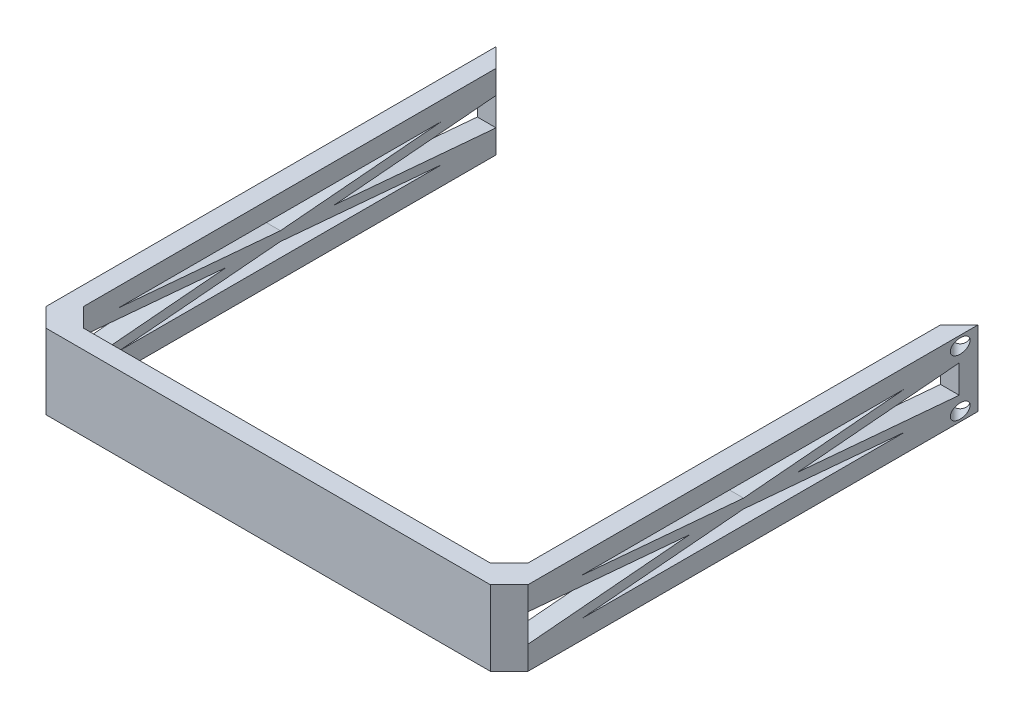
SolidWorks part; units mm, degrees
ref_plane "Front Plane" through (0, 0, 0) normal (0, 0, 1) x (1, 0, 0)
ref_plane "Top Plane" through (0, 0, 0) normal (0, 1, 0) x (1, 0, 0)
ref_plane "Right Plane" through (0, 0, 0) normal (1, 0, 0) x (0, 0, -1)
sketch "Sketch2" plane through (0, 0, 0) normal (0, 0, 1) x (1, 0, 0)
  line L1 (-16.0621, 9.0407) -> (-12.0621, 9.0407)
  line L2 (-16.0621, 9.0407) -> (-16.0621, -6.9593)
  line L3 (-16.0621, -6.9593) -> (-12.0621, -6.9593)
  line L4 (-12.0621, 9.0407) -> (-12.0621, -6.9593)
  dimension "D1" = 16
  dimension "D2" = 4
extrude "Boss-Extrude1" add sketch "Sketch2" along normal blind 100
sketch "Sketch3" plane through (-12.0621, 0, 0) normal (1, 0, 0) x (0, 0, -1)
  line L0 (-100, -6.9593) -> (0, -6.9593) construction
  line L1 (-100, 9.0407) -> (-96, 9.0407)
  line L2 (-100, 9.0407) -> (-100, -6.9593)
  line L3 (-100, -6.9593) -> (-96, -6.9593)
  line L4 (-96, 9.0407) -> (-96, -6.9593)
  dimension "D1" = 4
extrude "Boss-Extrude2" add sketch "Sketch3" along normal blind 47.395
chamfer "Chamfer1" distance 4 angle 45 1 edges at (-12.0621, 1.0407, 0)
sketch "Sketch4" plane through (-16.0621, 0, 0) normal (-1, 0, 0) x (0, 0, 1)
  line L4 (4, 5.0407) -> (96, -2.9593)
  line L5 (96, 5.0407) -> (4, -2.9593)
  line L6 (95.9134, 6.0369) -> (3.9134, -1.9631)
  line L7 (3.9134, 4.0444) -> (95.9134, -3.9556)
  line L8 (4, 5.0407) -> (4, -2.9593)
  line L9 (4, -2.9593) -> (96, -2.9593)
  line L10 (96, -2.9593) -> (96, 5.0407)
  line L11 (96, 5.0407) -> (4, 5.0407)
  line L12 (4, 5.0407) -> (4, -2.9593)
  line L13 (4, -2.9593) -> (96, -2.9593)
  line L14 (96, -2.9593) -> (96, 5.0407)
  line L15 (96, 5.0407) -> (4, 5.0407)
  line L16 (96.0866, 4.0444) -> (4.0866, -3.9556)
  line L17 (4.0866, 6.0369) -> (96.0866, -1.9631)
  dimension "D1" = 4
  dimension "D2" = 1
  dimension "D3" = 1
extrude "Cut-Extrude1" cut sketch "Sketch4" against normal blind 70 contours L15 L17 L6 | L16 L17 L14 | L7 L16 L13 | L7 L12 L6
chamfer "Chamfer2" distance 4 angle 45 3 edges at (-12.0621, 6.5388, 96) (-12.0621, -4.4574, 96) (-16.0621, 1.0407, 100)
sketch "Sketch5" plane through (-8.0311, 0, 8.0311) normal (0.7071, 0, -0.7071) x (-0.7071, 0, -0.7071)
  line L0 (11.3576, 9.0407) -> (11.3576, -6.9593) construction
  circle A0 centre (8.6735, 7.0407) radius 1.5
  circle A1 centre (8.6735, -4.9593) radius 1.5
  point P6 (11.3576, 1.0407)
  dimension "D1" = 3
  dimension "D2" = 3
  dimension "D3" = 12
  dimension "D4" = 6
extrude "Cut-Extrude2" cut sketch "Sketch5" against normal blind 70
mirror "Mirror1" about plane through (35.3329, 0, 0) normal (1, 0, 0) of "Cut-Extrude2", "Boss-Extrude1", "Boss-Extrude2", "Chamfer1", "Cut-Extrude1", "Chamfer2"
